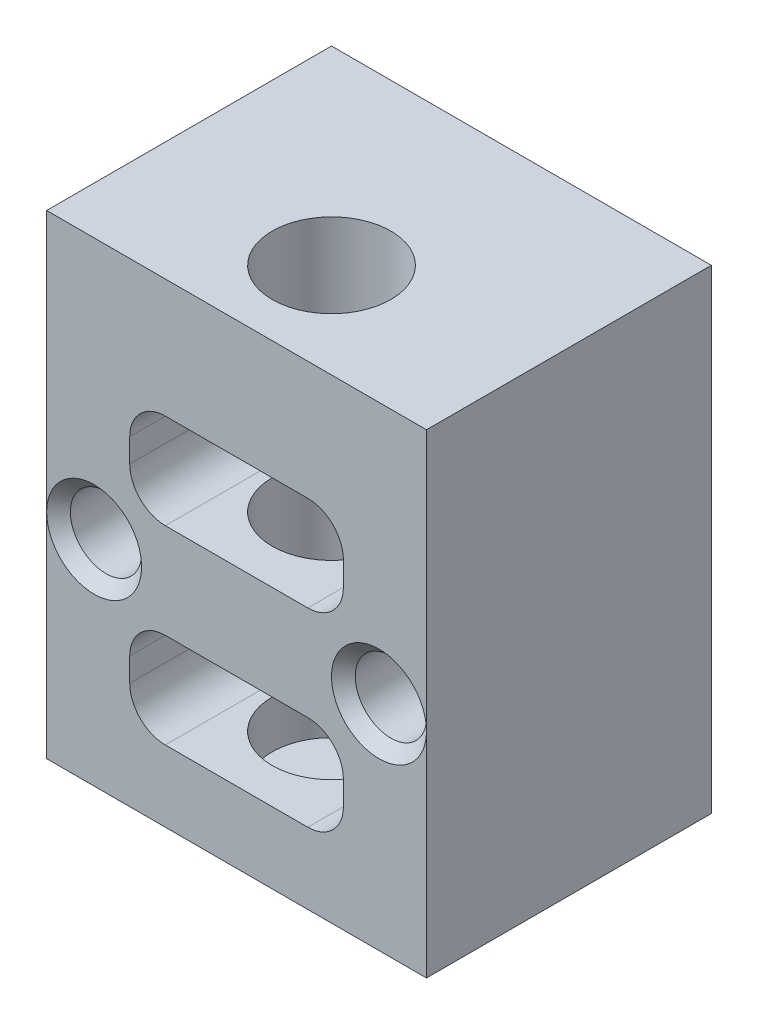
SolidWorks part; units mm, degrees
ref_plane "前视基准面" through (0, 0, 0) normal (0, 0, 1) x (1, 0, 0)
ref_plane "上视基准面" through (0, 0, 0) normal (0, 1, 0) x (1, 0, 0)
ref_plane "右视基准面" through (0, 0, 0) normal (1, 0, 0) x (0, 0, -1)
sketch "Sketch1" plane through (0, 0, 0) normal (0, 0, 1) x (1, 0, 0)
  line L1 (-8, -10) -> (8, -10)
  line L2 (-8, -10) -> (-8, 10)
  line L3 (-8, 10) -> (8, 10)
  line L4 (8, -10) -> (8, 10)
  line L5 (-8, -10) -> (8, 10) construction
  line L6 (-8, 10) -> (8, -10) construction
  point P0 (0, 0)
  dimension "D1" = 16
  dimension "D2" = 20
extrude "Boss-Extrude1" add sketch "Sketch1" along normal blind 12
sketch "Sketch2" plane through (0, 10, 0) normal (0, 1, 0) x (1, 0, 0)
  line L0 (0, 0) -> (0, -8) construction
  line L1 (8, 0) -> (-8, 0) construction
  circle A0 centre (0, -8) radius 2.5
  dimension "D1" = 5
  dimension "D2" = 8
extrude "Cut-Extrude1" cut sketch "Sketch2" against normal blind 19
sketch "Sketch3" plane through (0, 0, 12) normal (0, 0, 1) x (1, 0, 0)
  line L0 (8, 10) -> (-8, 10) construction
  line L3 (-3, 5) -> (3, 5)
  line L4 (-4.5, 3.5) -> (-4.5, 2.5)
  line L5 (-3, 1) -> (3, 1)
  line L6 (4.5, 3.5) -> (4.5, 2.5)
  line L7 (0, 5) -> (0, 10) construction
  line L8 (8, -1) -> (-8, -1) construction
  line L9 (8, -10) -> (8, 10) construction
  line L10 (-8, 10) -> (-8, -10) construction
  line L11 (4.5, -5.5) -> (4.5, -4.5)
  line L12 (-3, -3) -> (3, -3)
  line L13 (-4.5, -5.5) -> (-4.5, -4.5)
  line L14 (-3, -7) -> (3, -7)
  arc A2 (3, 5) -> (4.5, 3.5) centre (3, 3.5) cw
  arc A3 (3, 1) -> (4.5, 2.5) centre (3, 2.5) ccw
  arc A4 (-4.5, 2.5) -> (-3, 1) centre (-3, 2.5) ccw
  arc A5 (-3, 5) -> (-4.5, 3.5) centre (-3, 3.5) ccw
  arc A6 (-3, -7) -> (-4.5, -5.5) centre (-3, -5.5) cw
  arc A7 (-4.5, -4.5) -> (-3, -3) centre (-3, -4.5) cw
  arc A8 (3, -3) -> (4.5, -4.5) centre (3, -4.5) cw
  arc A9 (3, -7) -> (4.5, -5.5) centre (3, -5.5) ccw
  dimension "D1" = 1.5
  dimension "D2" = 6
  dimension "D3" = 4
  dimension "D4" = 5
  dimension "D5" = 4
extrude "Cut-Extrude2" cut sketch "Sketch3" against normal blind 8.5
sketch "Sketch4" plane through (0, 0, 12) normal (0, 0, 1) x (1, 0, 0)
  line L0 (0, 1) -> (0, -3) construction
  line L1 (-3, 1) -> (3, 1) construction
  line L2 (-2.5, -3) -> (2.5, -3) construction
  line L3 (-6, -1) -> (6, -1) construction
  circle A0 centre (6, -1) radius 1.5
  circle A1 centre (-6, -1) radius 1.5
  point P10 (0, -1)
  dimension "D2" = 3
  dimension "D1" = 12
extrude "Cut-Extrude3" cut sketch "Sketch4" against normal blind 24
chamfer "Chamfer1" distance 0.5 angle 45 2 edges at (7.5, -1, 12) (-7.5, -1, 12)
